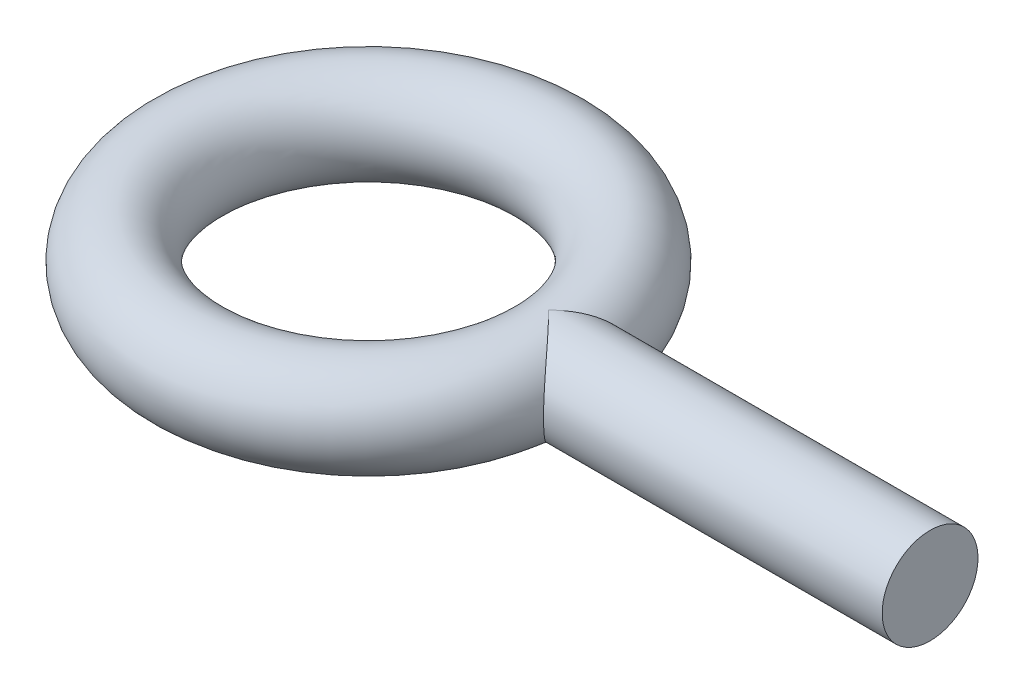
SolidWorks part; units mm, degrees
ref_plane "Front Plane" through (0, 0, 0) normal (0, 0, 1) x (1, 0, 0)
ref_plane "Top Plane" through (0, 0, 0) normal (0, 1, 0) x (1, 0, 0)
ref_plane "Right Plane" through (0, 0, 0) normal (1, 0, 0) x (0, 0, -1)
sketch "layout" plane through (0, 0, 0) normal (0, 1, 0) x (1, 0, 0)
  line L0 (0, 0) -> (37.211, 0) construction
  circle A0 centre (0, 0) radius 15.113 construction
  dimension "D1" = 30.226
  dimension "D2" = 52.324
sketch "Sketch2" plane through (0, 0, 0) normal (0, 0, 1) x (1, 0, 0)
  line L3 (0, 0) -> (0, 6.6909) construction
  line L4 (15.113, 0) -> (-15.113, 0) construction
  circle A0 centre (-11.938, 0) radius 3.175
  point P4 (-15.113, 0)
  dimension "D1" = 6.35
revolve "Revolve1" add sketch "Sketch2" angle 360 about L3
ref_plane "Plane1" through (37.211, 0, 0) normal (1, 0, 0) x (0, 0, -1)
sketch "Sketch3" plane through (37.211, 0, 0) normal (1, 0, 0) x (0, 0, -1)
  circle A0 centre (0, 0) radius 3.175
  dimension "A" = 6.35
extrude "Extrude1" add sketch "Sketch3" against normal up to next
sketch "Sketch4" plane through (0, 0, 0) normal (0, 1, 0) x (1, 0, 0)
  line L0 (36.7527, 3.175) -> (37.211, 2.3812)
  line L1 (37.211, 2.3812) -> (37.6693, 3.175)
  line L2 (37.6693, 3.175) -> (37.6693, 4.0915)
  line L3 (37.6693, 4.0915) -> (36.7527, 4.0915)
  line L4 (36.7527, 4.0915) -> (36.7527, 3.175)
  line L5 (0, 0) -> (42.1538, 0) construction
  dimension "D1" = 4.7625
  dimension "D2" = 6.35
revolve "Cut-Revolve1" [suppressed] cut sketch "Sketch4" angle 360 about L5
pattern_linear "LPattern1" [suppressed] count 15 along (1, 0, 0)
equation "\"A@Sketch3\" = \"D1@Sketch2\""
equation "\"D1@Sketch4\" = \"D2@Cosmetic Thread1\""
equation "\"D2@Sketch4\" = \"D1@Sketch2\""
equation "\"D1@LPattern1\" = \"D1@Cosmetic Thread1\" / \"p@LPattern1\""
